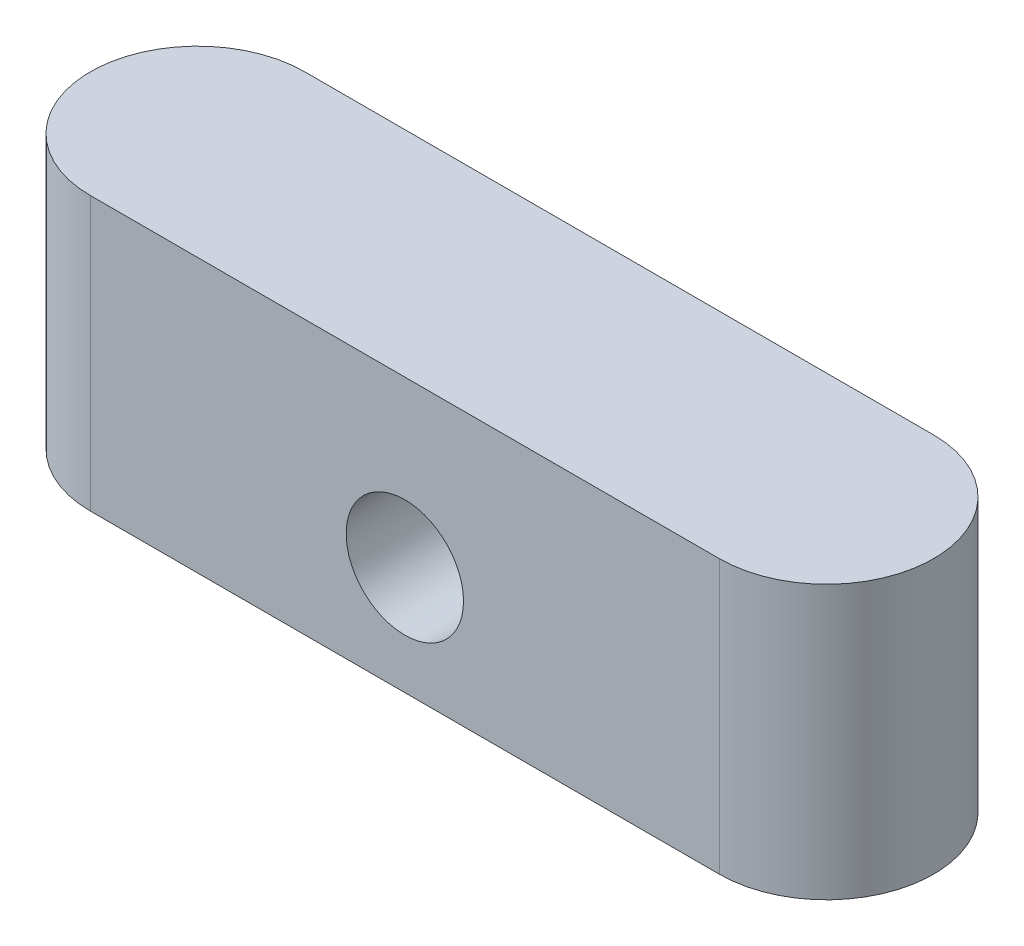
SolidWorks part; units mm, degrees
ref_plane "Front Plane" through (0, 0, 0) normal (0, 0, 1) x (1, 0, 0)
ref_plane "Top Plane" through (0, 0, 0) normal (0, 1, 0) x (1, 0, 0)
ref_plane "Right Plane" through (0, 0, 0) normal (1, 0, 0) x (0, 0, -1)
sketch "Sketch1" plane through (0, 0, 0) normal (0, 1, 0) x (1, 0, 0)
  line L0 (-7.25, 0) -> (7.25, 0) construction
  line L1 (-7.25, 2.4701) -> (7.25, 2.4702)
  line L2 (-7.25, -2.4701) -> (7.25, -2.4701)
  arc A0 (-7.25, 2.4701) -> (-7.25, -2.4701) centre (-7.25, 0) ccw
  arc A1 (7.25, -2.4701) -> (7.25, 2.4702) centre (7.25, 0) ccw
  point P2 (0, 0)
  dimension "D1" = 14.5
  dimension "D2" = 4.9403
extrude "Boss-Extrude1" add sketch "Sketch1" along normal mid plane 6.3
hole_wizard "#6-32 Tapped Hole1" positions "Sketch3" profile "Sketch2" tap size "#6-32" standard "ANSI Inch"
sketch "Sketch3" plane through (0, 0, 2.4701) normal (0, 0, 1) x (1, 0, 0)
  line L0 (-7.25, -3.15) -> (7.25, -3.15) construction
  point P0 (0, -0.65)
  dimension "D1" = 2.5
sketch "Sketch2" plane through (0, -0.65, 2.4701) normal (1, 0, 0) x (0, -1, 0)
  line L0 (0, 0) -> (0, 4.9403)
  line L1 (0, 4.9403) -> (1.3525, 4.9403)
  line L2 (1.3525, 4.9403) -> (1.3525, 0)
  line L5 (1.3525, 0) -> (0, 0)
  line L11 (0, -6.35) -> (0, 107.95) construction
  dimension "Thru Tap Drill Dia." = 2.7051
  dimension "Thru Tap Drill Depth" = 4.9403
